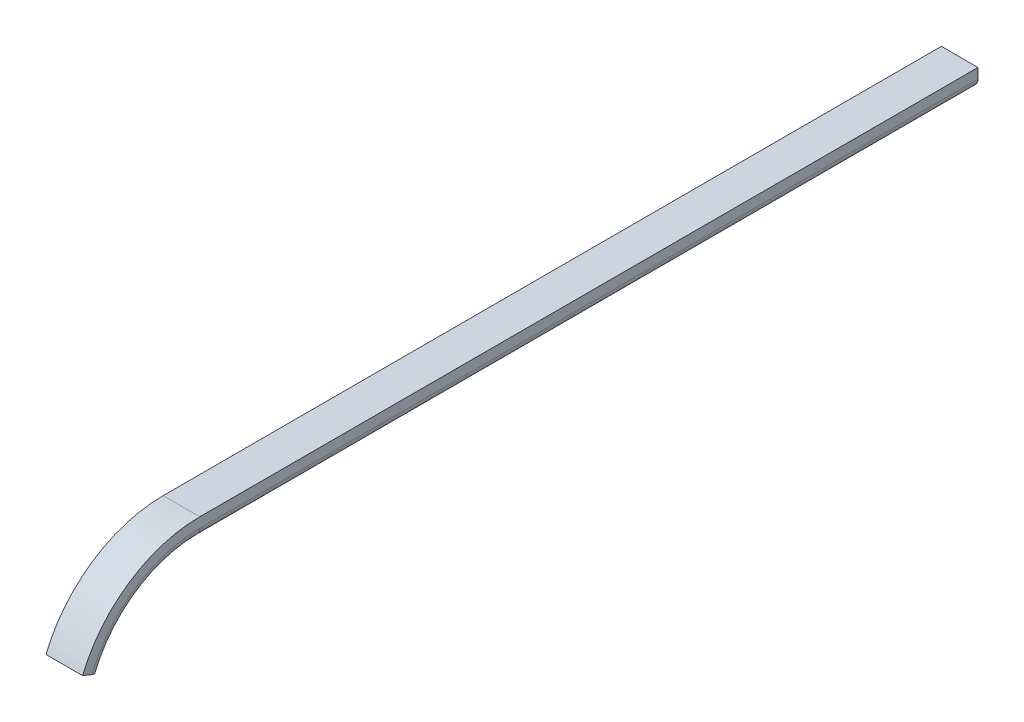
SolidWorks part; units mm, degrees
ref_plane "Plan de face" through (0, 0, 0) normal (0, 0, 1) x (1, 0, 0)
ref_plane "Plan de dessus" through (0, 0, 0) normal (0, 1, 0) x (1, 0, 0)
ref_plane "Plan de droite" through (0, 0, 0) normal (1, 0, 0) x (0, 0, -1)
sketch "Esquisse1" plane through (0, 0, 0) normal (0, 0, 1) x (1, 0, 0)
  line L0 (0, 0) -> (20, 0)
  line L1 (0, 0) -> (0, -3)
  line L2 (0, -3) -> (17, -3)
  line L3 (20, 0) -> (20, -5.5)
  line L4 (14.4114, -9.8663) -> (8.5739, -8.4109)
  line L5 (8.5739, -8.4109) -> (9.2997, -5.5)
  line L6 (9.2997, -5.5) -> (15.1371, -6.9554)
  line L7 (17, -3) -> (17, -5.5)
  arc A0 (20, -5.5) -> (14.4114, -9.8663) centre (15.5, -5.5) cw
  arc A1 (15.1371, -6.9554) -> (17, -5.5) centre (15.5, -5.5) ccw
  dimension "D5" = 1.5
  dimension "D1" = 20
  dimension "D2" = 3
  dimension "D3" = 17
  dimension "D4" = 5.5
  dimension "D6" = 76
  dimension "D7" = 2.5
extrude "Extrusion1" add sketch "Esquisse1" along normal blind 425
sketch "Esquisse2" plane through (0, 0, 425) normal (0, 0, 1) x (1, 0, 0)
  line L0 (0, 0) -> (20, 0)
  line L1 (20, 0) -> (20, -5.5)
  line L2 (14.4114, -9.8663) -> (8.5739, -8.4109)
  line L3 (8.5739, -8.4109) -> (9.2997, -5.5)
  line L4 (9.2997, -5.5) -> (15.1371, -6.9554)
  line L5 (17, -5.5) -> (17, -3)
  line L6 (17, -3) -> (0, -3)
  line L7 (0, -3) -> (0, 0)
  line L8 (-2.5369, -69) -> (22.7877, -69) construction
  arc A0 (20, -5.5) -> (14.4114, -9.8663) centre (15.5, -5.5) cw
  arc A1 (15.1371, -6.9554) -> (17, -5.5) centre (15.5, -5.5) ccw
  dimension "D1" = 66
revolve "Révolution1" add sketch "Esquisse2" angle 68 about L8
sketch "Esquisse3" plane through (0, 0, 0) normal (0, 0, -1) x (-1, 0, 0)
  line L0 (0, 0) -> (-20, 0)
  line L1 (-20, 0) -> (-20, -5.5)
  line L2 (-14.4114, -9.8663) -> (-8.5739, -8.4109)
  line L3 (-8.5739, -8.4109) -> (-9.2997, -5.5)
  line L4 (-9.2997, -5.5) -> (-15.1371, -6.9554)
  line L5 (-17, -5.5) -> (-17, -3)
  line L6 (-17, -3) -> (0, -3)
  line L7 (0, -3) -> (0, 0)
  line L8 (-30.2357, -69) -> (10.1051, -69) construction
  arc A0 (-20, -5.5) -> (-14.4114, -9.8663) centre (-15.5, -5.5) ccw
  arc A1 (-15.1371, -6.9554) -> (-17, -5.5) centre (-15.5, -5.5) cw
  dimension "D1" = 66
revolve "Révolution2" [suppressed] add sketch "Esquisse3" angle 68 about L8
